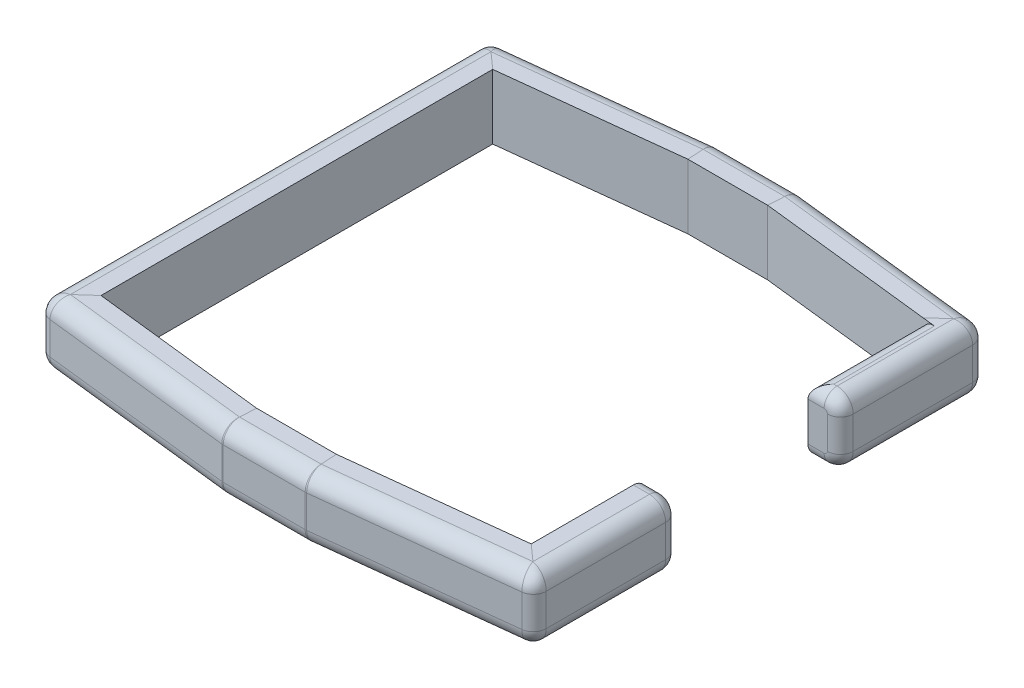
SolidWorks part; units mm, degrees
ref_plane "Front Plane" through (0, 0, 0) normal (0, 0, 1) x (1, 0, 0)
ref_plane "Top Plane" through (0, 0, 0) normal (0, 1, 0) x (1, 0, 0)
ref_plane "Right Plane" through (0, 0, 0) normal (1, 0, 0) x (0, 0, -1)
sketch "Sketch1" plane through (0, 0, 0) normal (0, 0, 1) x (1, 0, 0)
  line L0 (10.175, 48.8811) -> (53.975, 48.8811) construction
  line L1 (10.175, -78.1489) -> (53.975, -78.1489) construction
  line L2 (15.24, -78.1489) -> (10.175, -78.1489) construction
  line L3 (85.725, 17.1311) -> (85.725, -46.3989)
  line L6 (22.225, 17.1311) -> (22.225, -46.3989) construction
  line L7 (3.175, -71.1489) -> (3.175, 41.8811) construction
  line L8 (3.175, -71.1489) -> (3.175, 41.8811) construction
  line L9 (3.175, -71.1489) -> (10.175, -71.1489) construction
  line L10 (10.175, -71.1489) -> (10.175, -78.1489) construction
  line L11 (3.175, 41.8811) -> (10.175, 41.8811) construction
  line L12 (10.175, 41.8811) -> (10.175, 48.8811) construction
  line L13 (10.175, 41.8811) -> (10.175, -71.1489) construction
  line L14 (22.225, 48.8811) -> (22.225, -78.1489)
  line L15 (22.225, 48.8811) -> (53.975, 48.8811)
  line L16 (22.225, -78.1489) -> (53.975, -78.1489)
  arc A0 (85.725, 17.1311) -> (53.975, 48.8811) centre (53.975, 17.1311) ccw
  arc A1 (53.975, -78.1489) -> (85.725, -46.3989) centre (53.975, -46.3989) ccw
  dimension "D1" = 63.5
  dimension "D2" = 19.05
  dimension "D3" = 31.75
sketch "Sketch2" plane through (0, 48.8811, 0) normal (0, -1, 0) x (1, 0, 0)
  line L0 (10.175, -202.946) -> (10.175, 0) construction
  line L1 (-314.8107, -251.7253) -> (-5.4357, -216.8046) construction
  line L2 (-470.0486, -252.5459) -> (-329.397, -252.5459) construction
  line L3 (-484.2436, -251.7694) -> (-794.6922, -216.7276) construction
  line L4 (-810.2969, -202.7202) -> (-810.2969, 520.1638) construction
  line L5 (-484.2436, 569.213) -> (-794.6922, 534.1711) construction
  line L6 (-329.397, 569.9894) -> (-470.0486, 569.9894) construction
  line L7 (-5.4357, 534.2481) -> (-314.8107, 569.1688) construction
  line L8 (10.175, 317.3898) -> (10.175, 520.3358) construction
  line L9 (10.175, -215.0425) -> (10.175, 0)
  line L10 (-322.0808, -252.5459) -> (10.175, -215.0425)
  line L11 (-477.3648, -252.5459) -> (-322.0808, -252.5459)
  line L12 (-477.3648, -252.5459) -> (-810.2969, -214.9662)
  line L13 (-810.2969, -214.9662) -> (-810.2969, 532.4097)
  line L14 (-477.3648, 569.9894) -> (-810.2969, 532.4097)
  line L15 (-322.0808, 569.9894) -> (-477.3648, 569.9894)
  line L16 (10.175, 532.486) -> (-322.0808, 569.9894)
  line L17 (10.175, 317.3898) -> (10.175, 532.486)
ref_plane "Plane1" through (10.175, 48.8811, 0) normal (0, 0, 1) x (1, 0, 0)
sweep "Sweep19" add profiles "Sketch1" path "Sketch2"
fillet "Fillet1" radius 25.4 35 edges at (38.1, -78.1489, 317.3898) (38.1, 48.8811, 317.3898) (38.1, -78.1489, 0) (38.1, 48.8811, 0) (76.4256, -68.8495, 317.3898) (85.725, -14.6339, 317.3898) (76.4256, 39.5818, 317.3898) (76.4256, 39.5818, 591.6794) (76.4256, -68.8495, 591.6794) (85.725, -14.6339, 599.9881) (-318.3536, 39.5818, 636.24) (-317.8304, -14.6339, 645.5394) (-318.3536, -68.8495, 636.24) (-481.092, -68.8495, 636.24) (-481.6152, -14.6339, 645.5394) (-481.092, 39.5818, 636.24) (-876.5475, 39.5818, 591.603) (-885.8469, -14.6339, 599.9118) (-876.5475, -68.8495, 591.603) (-876.5475, 39.5818, -274.1595) (-876.5475, -68.8495, -274.1595) (-885.8469, -14.6339, -282.4682) (-481.092, 39.5818, -318.7965) (-481.6152, -14.6339, -328.0959) (-481.092, -68.8495, -318.7965) (-318.3536, -68.8495, -318.7965) (-318.3536, 39.5818, -318.7965) (76.4256, -68.8495, 0) (76.4256, -68.8495, -274.2358) (76.4256, 39.5818, 0) (76.4256, 39.5818, -274.2358) (85.725, -14.6339, 0) (85.725, -14.6339, -282.5446) (-317.8304, -14.6339, -328.0959) (22.225, 48.8811, -112.9045)
